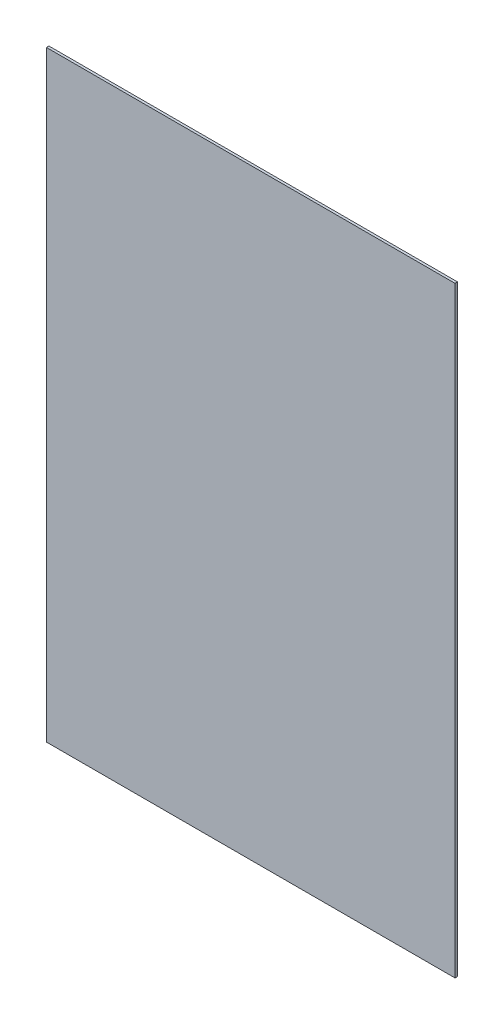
SolidWorks part; units mm, degrees
ref_plane "Front Plane" through (0, 0, 0) normal (0, 0, 1) x (1, 0, 0)
ref_plane "Top Plane" through (0, 0, 0) normal (0, 1, 0) x (1, 0, 0)
ref_plane "Right Plane" through (0, 0, 0) normal (1, 0, 0) x (0, 0, -1)
sketch "Sketch2" plane through (0, 0, 0) normal (0, 0, 1) x (1, 0, 0)
  line L1 (-457.2, -609.6) -> (457.2, -609.6)
  line L2 (-457.2, -609.6) -> (-457.2, 609.6)
  line L3 (-457.2, 609.6) -> (457.2, 609.6)
  line L4 (457.2, -609.6) -> (457.2, 609.6)
  line L5 (-457.2, -609.6) -> (457.2, 609.6) construction
  line L6 (-457.2, 609.6) -> (457.2, -609.6) construction
  point P0 (0, 0)
  dimension "D1" = 914.4
  dimension "D2" = 1219.2
extrude "Boss-Extrude1" add sketch "Sketch2" along normal mid plane 5.588
sketch "Sketch3" plane through (0, 609.6, 0) normal (0, 1, 0) x (1, 0, 0)
  line L4 (457.2, 2.794) -> (-457.2, 2.794)
  line L5 (-457.2, 2.794) -> (-457.2, -2.794)
  line L6 (-457.2, -2.794) -> (457.2, -2.794)
  line L7 (457.2, -2.794) -> (457.2, 2.794)
  line L8 (457.2, 2.794) -> (-457.2, 2.794)
  line L9 (-457.2, 2.794) -> (-457.2, -2.794)
  line L10 (-457.2, -2.794) -> (457.2, -2.794)
  line L11 (457.2, -2.794) -> (457.2, 2.794)
  dimension "D1" = 0
extrude "Boss-Extrude2" add sketch "Sketch3" along normal blind 127
